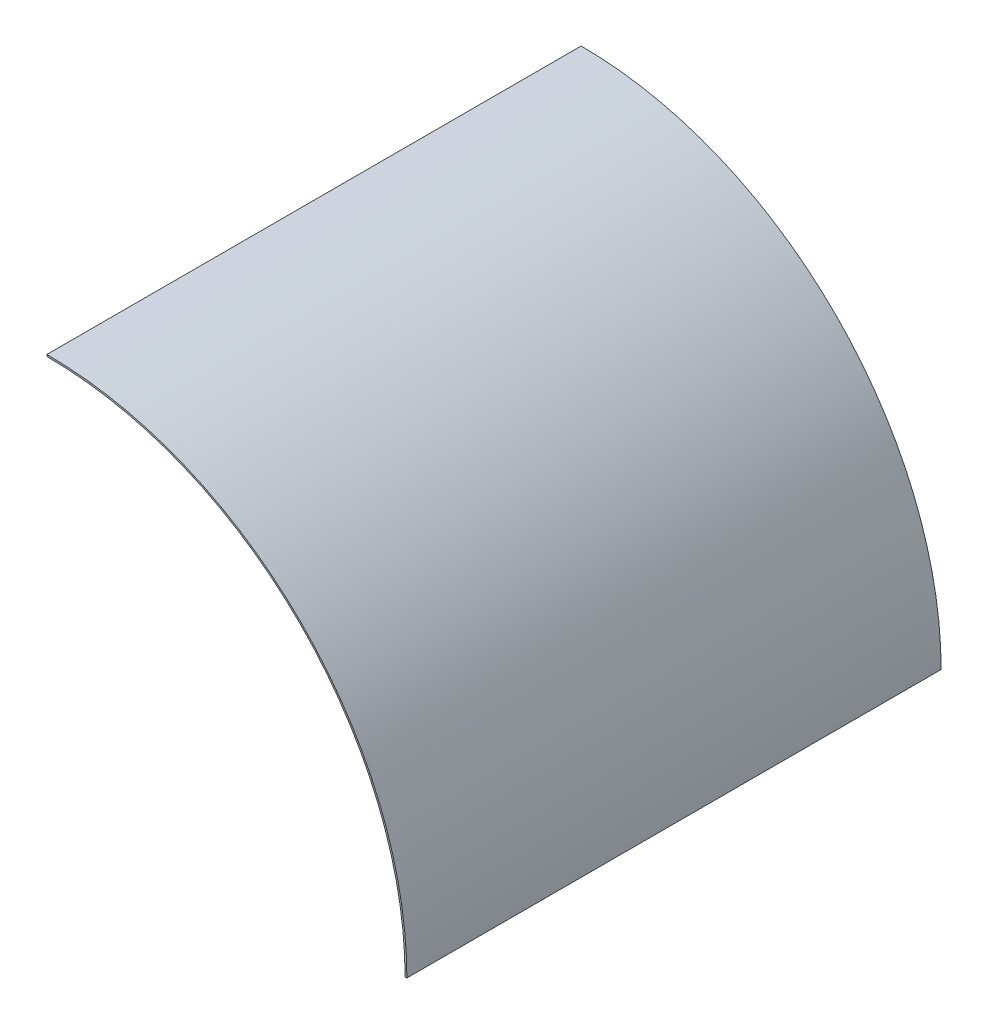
SolidWorks part; units mm, degrees
ref_plane "Front Plane" through (0, 0, 0) normal (0, 0, 1) x (1, 0, 0)
ref_plane "Top Plane" through (0, 0, 0) normal (0, 1, 0) x (1, 0, 0)
ref_plane "Right Plane" through (0, 0, 0) normal (1, 0, 0) x (0, 0, -1)
sketch "Sketch1" plane through (0, 0, 0) normal (0, 0, 1) x (1, 0, 0)
  line L0 (0, 0) -> (0, 47.3598) construction
  line L1 (0, 0) -> (40.0737, 0) construction
  line L2 (0, 2021.5) -> (0, 2011.5)
  line L3 (2011.5, 0) -> (2021.5, 0)
  arc A0 (0, 2021.5) -> (2021.5, 0) centre (0, 0) cw
  arc A1 (0, 2011.5) -> (2011.5, 0) centre (0, 0) cw
  dimension "D2" = 2011.5
  dimension "D1" = 10
extrude "Boss-Extrude1" add sketch "Sketch1" against normal blind 3000 contours A0 L3 A1 L2
